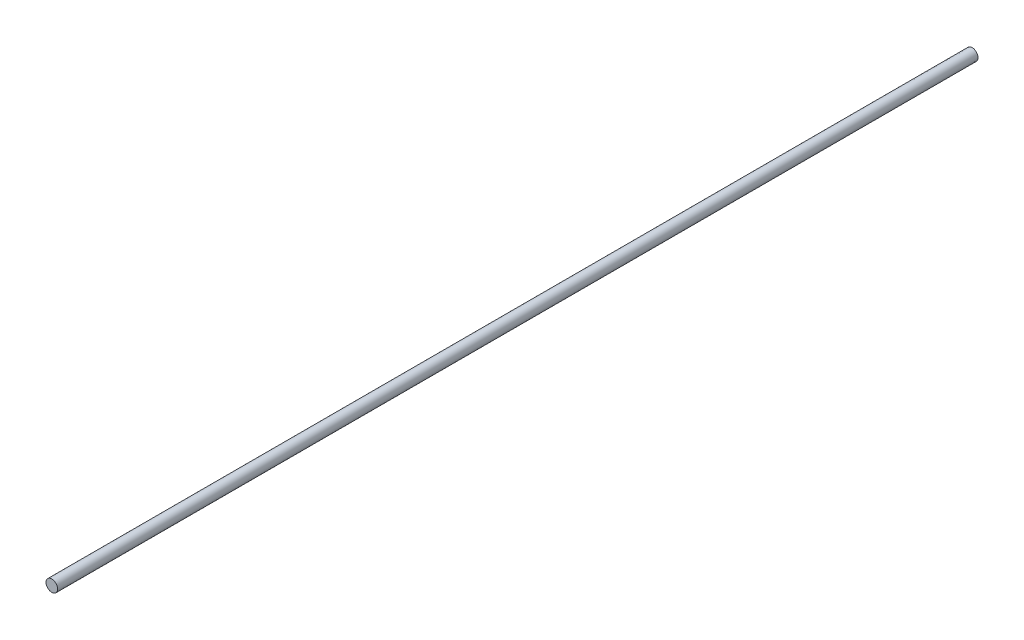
SolidWorks part; units mm, degrees
ref_plane "Plan de face" through (0, 0, 0) normal (0, 0, 1) x (1, 0, 0)
ref_plane "Plan de dessus" through (0, 0, 0) normal (0, 1, 0) x (1, 0, 0)
ref_plane "Plan de droite" through (0, 0, 0) normal (1, 0, 0) x (0, 0, -1)
sketch "Esquisse1" plane through (0, 0, 0) normal (0, 0, 1) x (1, 0, 0)
  circle A0 centre (0, 0) radius 6
  dimension "D1" = 12
extrude "Extrusion1" add sketch "Esquisse1" along normal mid plane 950
